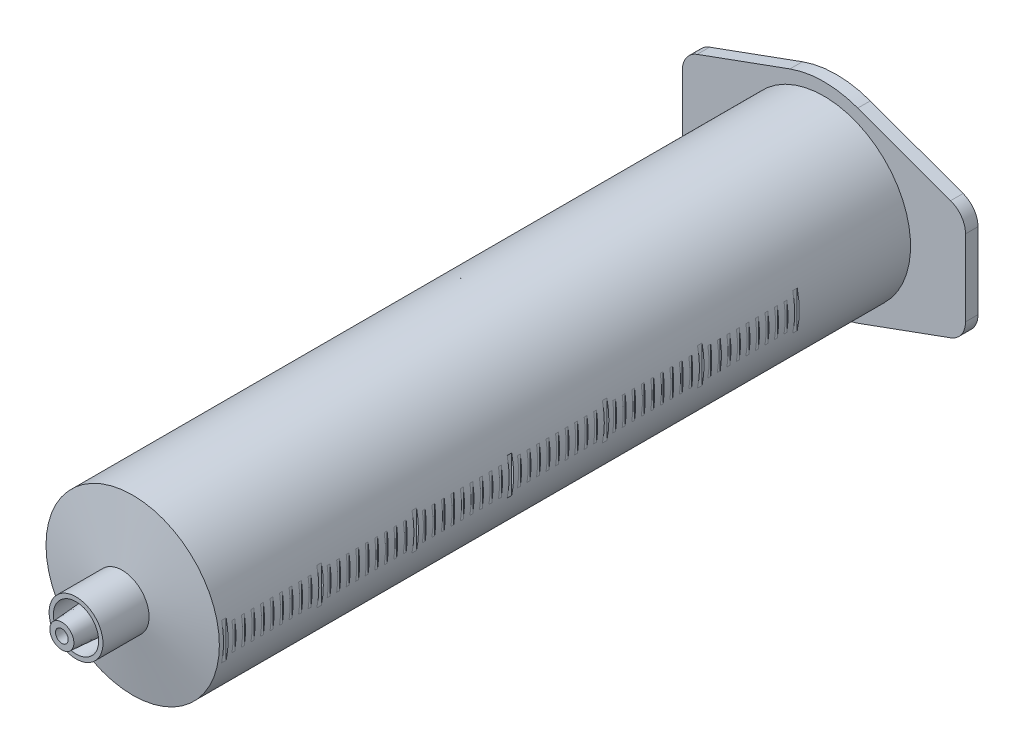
SolidWorks part; units mm, degrees
ref_plane "Face" through (0, 0, 0) normal (0, 0, 1) x (1, 0, 0)
ref_plane "Dessus" through (0, 0, 0) normal (0, 1, 0) x (1, 0, 0)
ref_plane "Droite" through (0, 0, 0) normal (1, 0, 0) x (0, 0, -1)
sketch "Esquisse1" plane through (0, 0, 0) normal (0, 0, 1) x (1, 0, 0)
  circle A0 centre (0, 0) radius 15.3
  dimension "D1" = 30.6
extrude "CYLINDRE" add sketch "Esquisse1" along normal blind 122
sketch "Esquisse2" plane through (0, 0, 122) normal (0, 0, 1) x (1, 0, 0)
  circle A0 centre (0, 0) radius 3
  dimension "D1" = 6
extrude "EMBOUT CONIQUE" add sketch "Esquisse2" along normal blind 12.5 draft 4
sketch "Esquisse3" plane through (0, 0, 122) normal (0, 0, 1) x (1, 0, 0)
  circle A0 centre (0, 0) radius 4.75
  circle A1 centre (0, 0) radius 4
  dimension "D1" = 9.5
  dimension "D2" = 8
extrude "TUBE" add sketch "Esquisse3" along normal blind 10
sketch "Esquisse4" plane through (0, 0, 122) normal (0, 0, 1) x (1, 0, 0)
  circle A1 centre (0, 0) radius 15.3 construction
  circle A2 centre (0, 0) radius 15.3
extrude "SURFACE CONIQUE" add sketch "Esquisse4" along normal blind 2 draft 80
shell "Coque1" thickness 1.5
sketch "Esquisse6" plane through (0, 0, 0) normal (0, 0, -1) x (-1, 0, 0)
  line L0 (-24.164, 0) -> (25.3953, 0) construction
  line L1 (0, 18.8797) -> (0, -21.958) construction
  line L2 (5.9854, 16.4446) -> (22.3681, 10.4818)
  line L3 (25, 6.723) -> (25, -6.723)
  line L4 (-25, 6.723) -> (-25, -6.723)
  line L5 (-5.9854, 16.4446) -> (-22.3681, 10.4818)
  line L6 (-5.9854, -16.4446) -> (-22.3681, -10.4818)
  line L7 (5.9854, -16.4446) -> (22.3681, -10.4818)
  arc A0 (5.9854, 16.4446) -> (-5.9854, 16.4446) centre (0, 0) ccw
  arc A1 (-5.9854, -16.4446) -> (5.9854, -16.4446) centre (0, 0) ccw
  arc A2 (-22.3681, 10.4818) -> (-25, 6.723) centre (-21, 6.723) ccw
  arc A3 (-22.3681, -10.4818) -> (-25, -6.723) centre (-21, -6.723) cw
  arc A4 (25, -6.723) -> (22.3681, -10.4818) centre (21, -6.723) cw
  arc A5 (25, 6.723) -> (22.3681, 10.4818) centre (21, 6.723) ccw
  circle A7 centre (0, 0) radius 13.8 construction
  circle A8 centre (0, 0) radius 13.8
  dimension "D2" = 17.5
  dimension "D4" = 4
  dimension "D1" = 50
  dimension "D3" = 20
extrude "AILETTES" add sketch "Esquisse6" along normal blind 2.2
ref_plane "Plan1" through (15.1, 0, 0) normal (1, 0, 0) x (0, 0, -1)
sketch "Esquisse7" plane through (15.1, 0, 0) normal (1, 0, 0) x (0, 0, -1)
  line L0 (0, 0) -> (-129.9184, 0) construction
  line L1 (-20.4544, 10) -> (-19.9544, 10)
  line L2 (-20.4544, 10) -> (-20.4544, -10)
  line L3 (-20.4544, -10) -> (-19.9544, -10)
  line L4 (-19.9544, 10) -> (-19.9544, -10)
  line L5 (-120.7414, -13.8) -> (-120.7414, 13.8) construction
  dimension "D1" = 20
  dimension "D2" = 10
  dimension "D3" = 0.5
  dimension "D4" = 100.287
extrude "Enlèv. mat.-Extru.1" cut sketch "Esquisse7" along normal through all
pattern_linear "Répétition linéaire1" count 60 spacing 1.68 along (0, 0, 1) of "Enlèv. mat.-Extru.1"
sketch "Esquisse8" plane through (15.1, 0, 0) normal (1, 0, 0) x (0, 0, -1)
  line L0 (-120.7414, -13.8) -> (-120.7414, 13.8) construction
  line L1 (-20.4544, 10) -> (-19.6544, 10)
  line L2 (-20.4544, 10) -> (-20.4544, -10)
  line L3 (-20.4544, -10) -> (-19.6544, -10)
  line L4 (-19.6544, 10) -> (-19.6544, -10)
  line L5 (0, 15.3) -> (0, -15.3) construction
  point P6 (0, 0)
  dimension "D1" = 0.8
  dimension "D2" = 100.287
  dimension "D3" = 20
  dimension "D4" = 10
extrude "Enlèv. mat.-Extru.2" cut sketch "Esquisse8" against normal blind 0.15 and the other way through all
pattern_linear "Répétition linéaire2" count 7 spacing 16.8 along (0, 0, 1) of "Enlèv. mat.-Extru.2"
